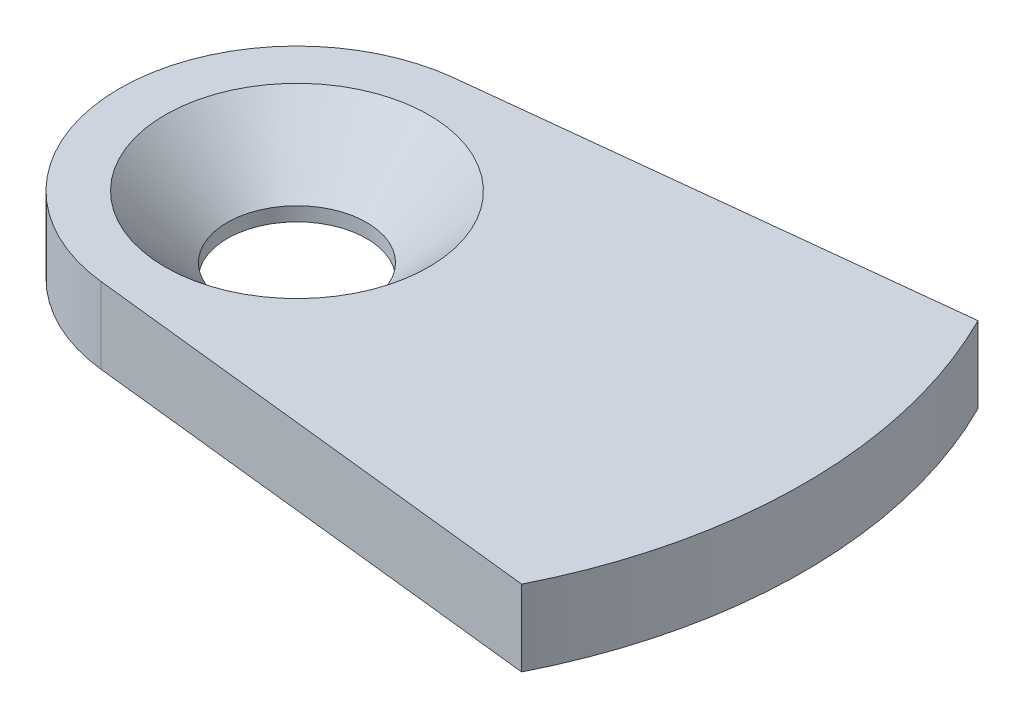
SolidWorks part; units mm, degrees
ref_plane "Front Plane" through (0, 0, 0) normal (0, 0, 1) x (1, 0, 0)
ref_plane "Top Plane" through (0, 0, 0) normal (0, 1, 0) x (1, 0, 0)
ref_plane "Right Plane" through (0, 0, 0) normal (1, 0, 0) x (0, 0, -1)
sketch "Sketch1" plane through (0, 0, 0) normal (0, 1, 0) x (1, 0, 0)
  line L0 (0, 0) -> (20, 0) construction
  line L1 (-0.7628, 6.9583) -> (17.8606, 9)
  line L2 (-0.7628, -6.9583) -> (17.8606, -9)
  arc A0 (-0.7628, 6.9583) -> (-0.7628, -6.9583) centre (0, 0) ccw
  arc A1 (17.8606, -9) -> (17.8606, 9) centre (0, 0) ccw
  dimension "D1" = 14
  dimension "D2" = 40
  dimension "D3" = 9
extrude "Extrude1" add sketch "Sketch1" along normal blind 3
sketch "Sketch2" plane through (0, 3, 0) normal (0, 1, 0) x (1, 0, 0)
  point P0 (0, 0)
hole_wizard "CSK for M5 Countersunk Flat Head Screw1" positions "3DSketch1" profile "Sketch4" countersink size "M5" standard "ISO"
sketch3d "3DSketch1"
  point P0 (0, 3, 0)
sketch "Sketch4" plane through (0, 3, 0) normal (1, 0, 0) x (0, 0, 1)
  line L0 (0, 0) -> (0, 3)
  line L1 (0, 3) -> (2.75, 3)
  line L2 (2.75, 3) -> (2.75, 2.45)
  line L3 (2.75, 2.45) -> (5.2, 0)
  line L5 (5.2, 0) -> (0, 0)
  line L6 (-2.75, 2.45) -> (-5.2, 0) construction
  line L11 (0, -6.35) -> (0, 107.95) construction
  dimension "Thru Hole Dia." = 5.5
  dimension "Thru Hole Depth" = 3
  dimension "Near C'Sink Dia." = 10.4
  dimension "Near C'Sink Angle" = 90
